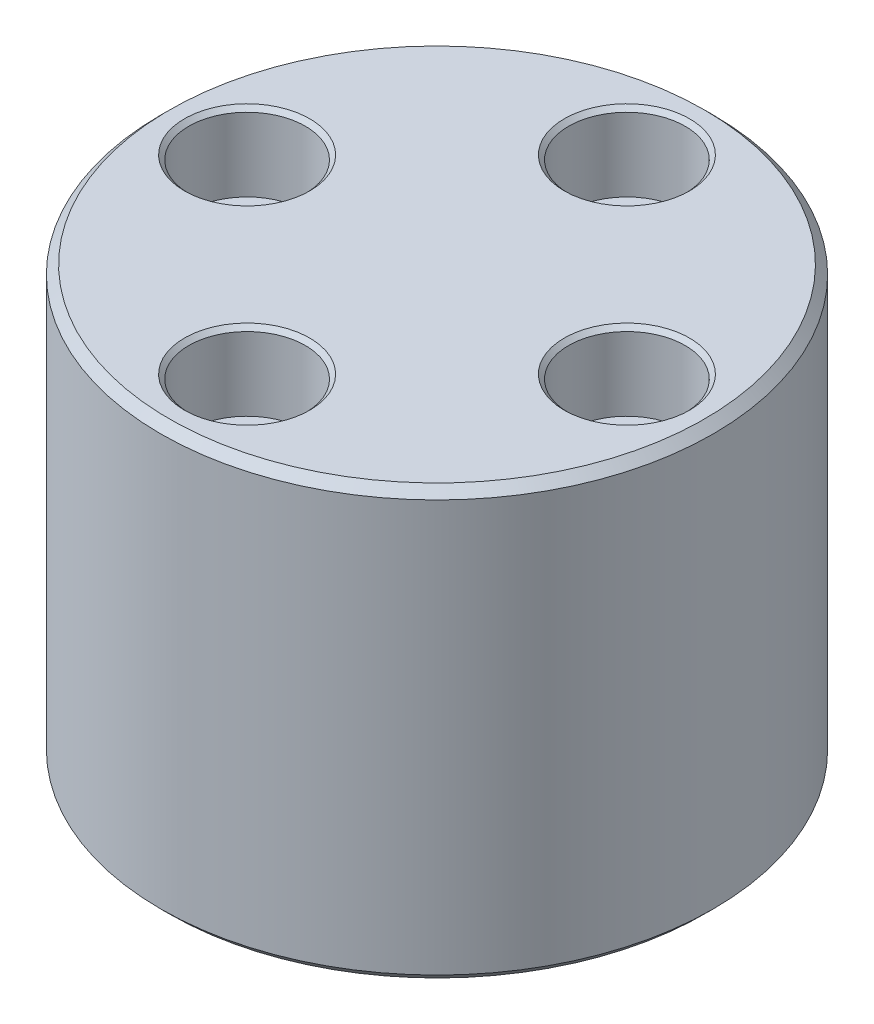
SolidWorks part; units mm, degrees
ref_plane "Front Plane" through (0, 0, 0) normal (0, 0, 1) x (1, 0, 0)
ref_plane "Top Plane" through (0, 0, 0) normal (0, 1, 0) x (1, 0, 0)
ref_plane "Right Plane" through (0, 0, 0) normal (1, 0, 0) x (0, 0, -1)
sketch "Sketch13" plane through (0, 0, 0) normal (0, 1, 0) x (1, 0, 0)
  circle A0 centre (0, 0) radius 25.4
  dimension "D1" = 50.8
extrude "Boss-Extrude1" add sketch "Sketch13" along normal blind 39.4208
hole_wizard "CBORE for 1/4 Socket Head Cap Screw1" positions "Sketch12" profile "Sketch11" counterbore size "1/4" standard "ANSI Inch"
sketch "Sketch12" plane through (0, 39.4208, 0) normal (0, 1, 0) x (1, 0, 0)
  line L0 (-1.5582, 0) -> (1.4946, 0) construction
  line L2 (0, 7.4878) -> (0, -7.2665) construction
  point P0 (0, 17.4625)
  point P2 (0, -17.4625)
  point P9 (-17.4625, 0)
  point P11 (17.4625, 0)
  dimension "D1" = 34.925
  dimension "D2" = 34.925
sketch "Sketch11" plane through (0, 39.4208, -17.4625) normal (1, 0, 0) x (0, 0, 1)
  line L0 (0, 0) -> (0, 39.4208)
  line L1 (0, 39.4208) -> (3.5712, 39.4208)
  line L3 (3.5712, 39.4208) -> (3.5712, 7.1425)
  line L4 (3.5712, 7.1425) -> (5.3594, 7.1425)
  line L5 (5.3594, 7.1425) -> (5.3594, 0)
  line L7 (5.3594, 0) -> (0, 0)
  line L11 (0, -6.35) -> (0, 107.95) construction
  dimension "Thru Hole Dia." = 7.1425
  dimension "Thru Hole Depth" = 39.4208
  dimension "C'Bore Dia." = 10.7188
  dimension "C'Bore Depth" = 7.1425
chamfer "Chamfer1" distance 0.7937 angle 45 2 edges at (0, 0, 25.4) (0, 39.4208, 25.4)
chamfer "Chamfer2" distance 0.3969 angle 45 8 edges at (0, 0, 21.0337) (17.4625, 0, 3.5712) (0, 0, -13.8913) (-17.4625, 0, 3.5712) (0, 39.4208, 22.8219) (17.4625, 39.4208, 5.3594) (0, 39.4208, -12.1031) (-17.4625, 39.4208, 5.3594)
